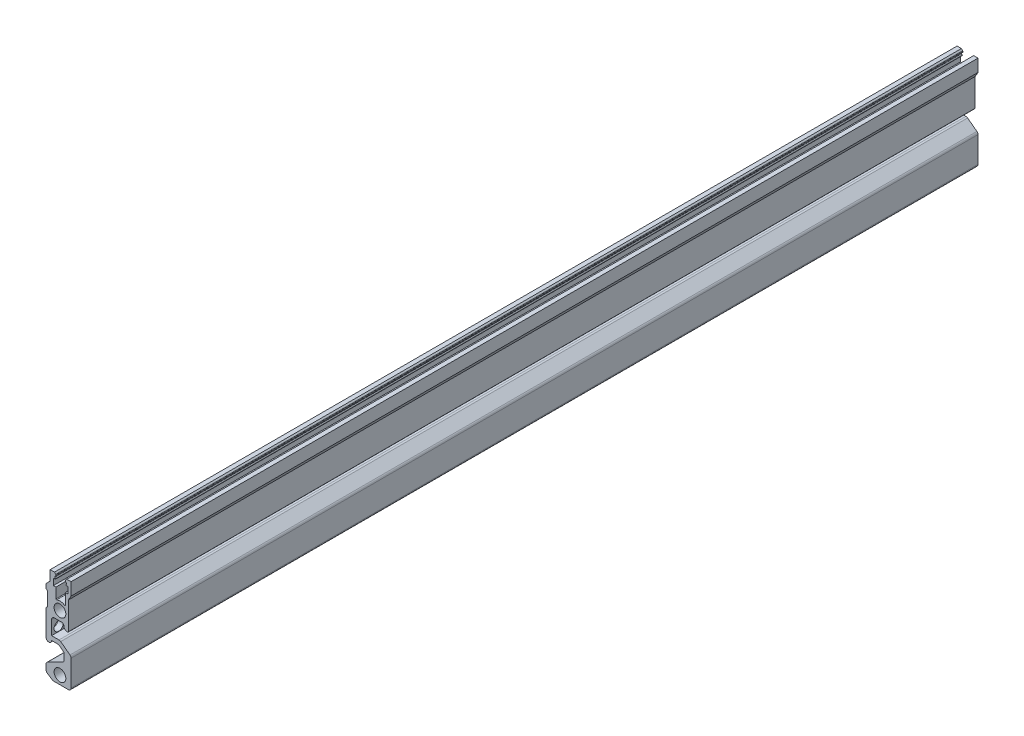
SolidWorks part; units mm, degrees
ref_plane "前视基准面" through (0, 0, 0) normal (0, 0, 1) x (1, 0, 0)
ref_plane "上视基准面" through (0, 0, 0) normal (0, 1, 0) x (1, 0, 0)
ref_plane "右视基准面" through (0, 0, 0) normal (1, 0, 0) x (0, 0, -1)
sketch "草图1" plane through (0, 0, 0) normal (0, 0, 1) x (1, 0, 0)
  line L0 (-2.3509, 8.9116) -> (-2.3509, 6.6116)
  line L1 (-2.3509, 8.9116) -> (-1.4509, 8.9116)
  line L2 (-1.4509, 8.9116) -> (-1.4509, 11.7916)
  line L3 (-1.4509, 11.7916) -> (-4.1259, 11.7916)
  line L4 (-4.1259, 11.7916) -> (-4.1259, 10.0616)
  line L5 (-4.1259, 10.0616) -> (-3.5009, 9.8916)
  line L6 (-3.5009, 9.8916) -> (-3.5009, 8.5216)
  line L7 (-3.5009, 8.5216) -> (-5.0009, 8.5216)
  line L8 (-5.0009, 8.5216) -> (-5.0009, 4.4416)
  line L9 (-5.0009, 4.4416) -> (-4.5507, 3.9414)
  line L10 (-4.5507, 3.9414) -> (-4.551, -1.0586)
  line L11 (-4.551, -1.0586) -> (-5.0009, -1.5584)
  line L12 (-5.0009, -1.5584) -> (-5.0009, -10.75)
  line L13 (-3.0009, -9.25) -> (-3.0009, -5.75)
  line L14 (2.9991, -5.05) -> (2.9991, -2.0584)
  line L15 (3.2991, -1.7584) -> (3.6991, -1.7584)
  line L16 (3.9991, -2.0584) -> (3.9991, -3.4584)
  line L17 (4.2991, -3.7584) -> (4.6991, -3.7584)
  line L18 (4.9991, -3.4584) -> (4.9991, 2.6416)
  line L19 (4.6991, 2.9416) -> (4.2991, 2.9416)
  line L20 (3.9991, 2.6416) -> (3.9991, 1.2416)
  line L21 (3.6991, 0.9416) -> (3.2991, 0.9416)
  line L22 (2.9991, 1.2416) -> (2.9991, 4.8054)
  line L23 (2.9991, 4.8054) -> (3.9991, 6.5374)
  line L24 (3.9991, 6.5374) -> (3.9991, 9.5216)
  line L25 (3.9991, 9.5216) -> (3.1241, 9.5216)
  line L26 (3.1241, 10.7916) -> (3.1241, 11.7916)
  line L27 (3.1241, 11.7916) -> (1.9491, 11.7916)
  line L28 (1.9491, 11.7916) -> (1.9491, 8.9116)
  line L29 (1.9491, 8.9116) -> (2.8491, 8.9116)
  line L30 (2.8491, 6.6116) -> (2.8491, 8.9116)
  line L31 (2.8491, 6.6116) -> (1.9491, 6.6116)
  line L32 (1.9491, 6.6116) -> (1.9491, 2.6797)
  line L33 (-1.4509, 2.9454) -> (-1.4509, 6.6116)
  line L34 (-1.4509, 6.6116) -> (-2.3509, 6.6116)
  line L35 (0, 0) -> (0, -5) construction
  line L39 (-2.5009, -5.25) -> (2.7991, -5.25)
  line L40 (-1.4509, 10.3516) -> (1.9491, 10.3516) construction
  line L41 (-3.0009, -10.75) -> (-5.0009, -10.75) construction
  line L42 (0.2491, 10.3516) -> (0.2491, 6.8507) construction
  line L43 (1.4991, -10.75) -> (1.4991, -17.25)
  line L44 (2.9991, -10.05) -> (2.9991, -22.2)
  line L45 (-3.0009, -10.75) -> (1.4991, -10.75)
  line L46 (-3.0009, -9.25) -> (2.1991, -9.25)
  line L47 (-5.0009, -22.2) -> (-5.0009, -18.05)
  line L48 (2.1991, -23) -> (-4.2009, -23)
  line L49 (-4.2009, -17.25) -> (1.4991, -17.25)
  arc A1 (3.2991, -1.7584) -> (2.9991, -2.0584) centre (3.2991, -2.0584) ccw
  arc A2 (3.9991, -2.0584) -> (3.6991, -1.7584) centre (3.6991, -2.0584) ccw
  arc A3 (3.9991, -3.4584) -> (4.2991, -3.7584) centre (4.2991, -3.4584) ccw
  arc A4 (4.6991, -3.7584) -> (4.9991, -3.4584) centre (4.6991, -3.4584) ccw
  arc A5 (4.9991, 2.6416) -> (4.6991, 2.9416) centre (4.6991, 2.6416) ccw
  arc A6 (4.2991, 2.9416) -> (3.9991, 2.6416) centre (4.2991, 2.6416) ccw
  arc A7 (3.6991, 0.9416) -> (3.9991, 1.2416) centre (3.6991, 1.2416) ccw
  arc A8 (2.9991, 1.2416) -> (3.2991, 0.9416) centre (3.2991, 1.2416) ccw
  arc A9 (3.1241, 10.7916) -> (3.1241, 9.5216) centre (3.1841, 10.1566) ccw
  circle A10 centre (0, 0) radius 1.6
  arc A11 (1.6398, 2.5122) -> (-1.1727, 2.7613) centre (0, 0) ccw
  arc A12 (1.6398, 2.5122) -> (1.9491, 2.6797) centre (1.7491, 2.6797) ccw
  arc A13 (-1.4509, 2.9454) -> (-1.1727, 2.7613) centre (-1.2509, 2.9454) ccw
  arc A17 (-4.2009, -17.25) -> (-5.0009, -18.05) centre (-4.2009, -18.05) ccw
  arc A18 (2.1991, -23) -> (2.9991, -22.2) centre (2.1991, -22.2) ccw
  arc A19 (2.7991, -5.25) -> (2.9991, -5.05) centre (2.7991, -5.05) ccw
  arc A20 (-3.0009, -5.75) -> (-2.5009, -5.25) centre (-2.5009, -5.75) cw
  circle A21 centre (0, -20) radius 1.6
  arc A22 (-5.0009, -22.2) -> (-4.2009, -23) centre (-4.2009, -22.2) ccw
  arc A23 (2.9991, -10.05) -> (2.1991, -9.25) centre (2.1991, -10.05) ccw
  arc A28 (-5.0009, -10.75) -> (-3.0009, -10.75) centre (-4.0009, -10.75) ccw
  dimension "D3" = 1.5
  dimension "D6" = 3.2
  dimension "D7" = 20
  dimension "D17" = 0.8
  dimension "D18" = 0.8
  dimension "D19" = 0.8
  dimension "D20" = 0.8
  dimension "D5" = 5.2
  dimension "D8" = 1
  dimension "D10" = 34.7916
  dimension "D12" = 5.75
  dimension "D13" = 13.75
  dimension "D16" = 8
extrude "凸台-拉伸1" add sketch "草图1" along normal mid plane 325.12
sketch "草图2" plane through (0, 0, -162.56) normal (0, 0, -1) x (-1, 0, 0)
  circle A0 centre (0, 0) radius 2.1
  circle A1 centre (0, -20) radius 2.1
  dimension "D1" = 4.2
  dimension "D2" = 4.2
extrude "切除-拉伸1" cut sketch "草图2" against normal blind 10
sketch "草图3" plane through (0, 0, 162.56) normal (0, 0, 1) x (1, 0, 0)
  circle A0 centre (0, 0) radius 2.1
  circle A1 centre (0, -20) radius 2.1
  dimension "D1" = 4.2
  dimension "D2" = 4.2
extrude "切除-拉伸2" cut sketch "草图3" against normal blind 10
sketch "草图4" plane through (-5.0009, 0, 0) normal (-1, 0, 0) x (0, 0, 1)
  line L0 (-162.56, -1.5584) -> (-162.56, -10.75) construction
  line L2 (-162.56, -11.75) -> (162.56, -11.75) construction
  circle A0 centre (-160.02, -7.5) radius 1.65
  circle A1 centre (-154.94, -7.5) radius 1.65
  circle A2 centre (-149.86, -7.5) radius 1.65
  circle A3 centre (-144.78, -7.5) radius 1.65
  circle A4 centre (-139.7, -7.5) radius 1.65
  circle A5 centre (-134.62, -7.5) radius 1.65
  circle A6 centre (-129.54, -7.5) radius 1.65
  circle A7 centre (-124.46, -7.5) radius 1.65
  circle A8 centre (-119.38, -7.5) radius 1.65
  circle A9 centre (-114.3, -7.5) radius 1.65
  circle A10 centre (-109.22, -7.5) radius 1.65
  circle A11 centre (-104.14, -7.5) radius 1.65
  circle A12 centre (-99.06, -7.5) radius 1.65
  circle A13 centre (-93.98, -7.5) radius 1.65
  circle A14 centre (-88.9, -7.5) radius 1.65
  circle A15 centre (-83.82, -7.5) radius 1.65
  circle A16 centre (-78.74, -7.5) radius 1.65
  circle A17 centre (-73.66, -7.5) radius 1.65
  circle A18 centre (-68.58, -7.5) radius 1.65
  circle A19 centre (-63.5, -7.5) radius 1.65
  circle A20 centre (-58.42, -7.5) radius 1.65
  circle A21 centre (-53.34, -7.5) radius 1.65
  circle A22 centre (-48.26, -7.5) radius 1.65
  circle A23 centre (-43.18, -7.5) radius 1.65
  circle A24 centre (-38.1, -7.5) radius 1.65
  circle A25 centre (-33.02, -7.5) radius 1.65
  circle A26 centre (-27.94, -7.5) radius 1.65
  circle A27 centre (-22.86, -7.5) radius 1.65
  circle A28 centre (-17.78, -7.5) radius 1.65
  circle A29 centre (-12.7, -7.5) radius 1.65
  circle A30 centre (-7.62, -7.5) radius 1.65
  circle A31 centre (-2.54, -7.5) radius 1.65
  circle A32 centre (2.54, -7.5) radius 1.65
  circle A33 centre (7.62, -7.5) radius 1.65
  circle A34 centre (12.7, -7.5) radius 1.65
  circle A35 centre (17.78, -7.5) radius 1.65
  circle A36 centre (22.86, -7.5) radius 1.65
  circle A37 centre (27.94, -7.5) radius 1.65
  circle A38 centre (33.02, -7.5) radius 1.65
  circle A39 centre (38.1, -7.5) radius 1.65
  circle A40 centre (43.18, -7.5) radius 1.65
  circle A41 centre (48.26, -7.5) radius 1.65
  circle A42 centre (53.34, -7.5) radius 1.65
  circle A43 centre (58.42, -7.5) radius 1.65
  circle A44 centre (63.5, -7.5) radius 1.65
  circle A45 centre (68.58, -7.5) radius 1.65
  circle A46 centre (73.66, -7.5) radius 1.65
  circle A47 centre (78.74, -7.5) radius 1.65
  circle A48 centre (83.82, -7.5) radius 1.65
  circle A49 centre (88.9, -7.5) radius 1.65
  circle A50 centre (93.98, -7.5) radius 1.65
  circle A51 centre (99.06, -7.5) radius 1.65
  circle A52 centre (104.14, -7.5) radius 1.65
  circle A53 centre (109.22, -7.5) radius 1.65
  circle A54 centre (114.3, -7.5) radius 1.65
  circle A55 centre (119.38, -7.5) radius 1.65
  circle A56 centre (124.46, -7.5) radius 1.65
  circle A57 centre (129.54, -7.5) radius 1.65
  circle A58 centre (134.62, -7.5) radius 1.65
  circle A59 centre (139.7, -7.5) radius 1.65
  circle A60 centre (144.78, -7.5) radius 1.65
  circle A61 centre (149.86, -7.5) radius 1.65
  circle A62 centre (154.94, -7.5) radius 1.65
  circle A63 centre (160.02, -7.5) radius 1.65
  circle A64 centre (165.1, -7.5) radius 1.65
  circle A65 centre (170.18, -7.5) radius 1.65
  circle A66 centre (175.26, -7.5) radius 1.65
  circle A67 centre (180.34, -7.5) radius 1.65
  circle A68 centre (185.42, -7.5) radius 1.65
  circle A69 centre (190.5, -7.5) radius 1.65
  circle A70 centre (195.58, -7.5) radius 1.65
  circle A71 centre (200.66, -7.5) radius 1.65
  circle A72 centre (205.74, -7.5) radius 1.65
  circle A73 centre (210.82, -7.5) radius 1.65
  circle A74 centre (215.9, -7.5) radius 1.65
  circle A75 centre (220.98, -7.5) radius 1.65
  circle A76 centre (226.06, -7.5) radius 1.65
  circle A77 centre (231.14, -7.5) radius 1.65
  circle A78 centre (236.22, -7.5) radius 1.65
  circle A79 centre (241.3, -7.5) radius 1.65
  circle A80 centre (246.38, -7.5) radius 1.65
  circle A81 centre (251.46, -7.5) radius 1.65
  circle A82 centre (256.54, -7.5) radius 1.65
  circle A83 centre (261.62, -7.5) radius 1.65
  circle A84 centre (266.7, -7.5) radius 1.65
  dimension "D1" = 3.3
  dimension "D5" = 5.08
  dimension "D3" = 4.25
  dimension "D2" = 2.54
  dimension "D4" = 85
extrude "切除-拉伸3" cut sketch "草图4" against normal blind 12
sketch "草图5" plane through (0, 0, 162.56) normal (0, 0, 1) x (1, 0, 0)
  line L0 (1.9491, 8.9116) -> (2.8491, 8.9116) construction
  line L1 (1.9491, 8.9116) -> (3.9991, 8.9116)
  line L2 (1.9491, 8.9116) -> (1.9491, 11.7916)
  line L3 (1.9491, 11.7916) -> (3.9991, 11.7916)
  line L4 (3.9991, 8.9116) -> (3.9991, 11.7916)
  line L5 (3.1241, 11.7916) -> (1.9491, 11.7916) construction
  line L6 (3.9991, 6.5374) -> (3.9991, 9.5216) construction
  line L7 (-1.4509, 11.7916) -> (-4.1259, 11.7916) construction
  line L8 (-5.0009, 8.5216) -> (-2.7884, 8.5216)
  line L9 (-5.0009, 8.5216) -> (-5.0009, 11.7916)
  line L10 (-5.0009, 11.7916) -> (-2.7884, 11.7916)
  line L11 (-2.7884, 8.5216) -> (-2.7884, 11.7916)
extrude "凸台-拉伸2" add sketch "草图5" against normal up to surface (325.12 mm away)
sketch "草图6" plane through (0, 0, -162.56) normal (0, 0, -1) x (-1, 0, 0)
  line L0 (-1.9491, 9.4916) -> (1.4509, 9.4916) construction
  line L1 (-1.9491, 11.7916) -> (-1.9491, 8.9116) construction
  line L2 (1.4509, 8.9116) -> (1.4509, 11.7916) construction
  line L3 (1.4509, 11.7916) -> (5.0009, 11.7916) construction
  line L4 (-2.3491, 8.9916) -> (1.8509, 8.9916)
  line L5 (-2.3491, 8.9916) -> (-2.3491, 9.9916)
  line L6 (-2.3491, 9.9916) -> (1.8509, 9.9916)
  line L7 (1.8509, 8.9916) -> (1.8509, 9.9916)
  line L8 (-2.3491, 8.9916) -> (1.8509, 9.9916) construction
  line L9 (-2.3491, 9.9916) -> (1.8509, 8.9916) construction
  point P6 (-0.2491, 9.4916)
  dimension "D1" = 1
  dimension "D2" = 4.2
  dimension "D3" = 1.8
extrude "切除-拉伸4" cut sketch "草图6" against normal through all
sketch "草图8" plane through (0, 0, -162.56) normal (0, 0, -1) x (-1, 0, 0)
  line L0 (5.0009, 11.7916) -> (5.0009, 4.4416) construction
  line L1 (-3.9991, 11.7916) -> (5.0009, 11.7916)
  line L2 (-3.9991, 11.7916) -> (-3.9991, 11.0016)
  line L3 (-3.9991, 11.0016) -> (5.0009, 11.0016)
  line L4 (5.0009, 11.7916) -> (5.0009, 11.0016)
  dimension "D1" = 0.79
extrude "切除-拉伸6" cut sketch "草图8" against normal through all
fillet "圆角1" radius 0.5 4 edges at (-1.8509, 9.9916, 0) (-1.8509, 8.9916, 0) (2.3491, 9.9916, 0) (2.3491, 8.9916, 0)
chamfer "倒角1" distance 0.5 angle 45 2 edges at (-1.4509, 11.0016, 0) (1.9491, 11.0016, 0)
fillet "圆角2" radius 0.2 6 edges at (1.9491, 10.5016, 0) (-1.4509, 10.5016, 0) (-1.4509, 8.9916, 0) (-1.4509, 9.9916, 0) (1.9491, 8.9916, 0) (1.9491, 9.9916, 0)
fillet "圆角3" radius 0.1 2 edges at (-1.4509, 8.9116, 0) (1.9491, 8.9116, 0)
sketch "草图7" plane through (0, 0, -162.56) normal (0, 0, -1) x (-1, 0, 0)
  line L0 (5.0009, 11.0016) -> (3.5009, 11.0016)
  line L2 (3.5009, 11.0016) -> (3.5009, 7.4416)
  line L3 (3.5009, 7.4416) -> (5.0009, 5.9416)
  line L4 (5.0009, 11.0016) -> (5.0009, 4.4416) construction
  line L5 (5.0009, 5.9416) -> (5.0009, 11.0016)
  line L6 (1.4509, 10.1341) -> (1.4509, 10.4187) construction
  line L7 (1.9509, 11.0016) -> (5.0009, 11.0016) construction
  dimension "D1" = 2.05
  dimension "D2" = 1.5
  dimension "D3" = 45
extrude "切除-拉伸5" cut sketch "草图7" against normal through all
sketch "草图10" plane through (0, 0, -162.56) normal (0, 0, -1) x (-1, 0, 0)
  line L0 (5.0009, -19.75) -> (1.0009, -23)
  line L3 (5.0009, -18.05) -> (5.0009, -22.2) construction
  line L4 (4.2009, -23) -> (-2.1991, -23) construction
  line L5 (1.0009, -23) -> (6.263, -23)
  line L6 (6.263, -23) -> (6.263, -19.75)
  line L7 (6.263, -19.75) -> (5.0009, -19.75)
  line L8 (-1.4991, -17.25) -> (4.2009, -17.25) construction
  dimension "D1" = 2.5
  dimension "D2" = 4
extrude "切除-拉伸7" [suppressed] cut sketch "草图10" against normal through all
fillet "圆角4" [suppressed] radius 0.8
sketch "草图11" plane through (0, 0, -162.56) normal (0, 0, -1) x (-1, 0, 0)
  line L2 (5.0009, -18.05) -> (5.0009, -22.2) construction
  line L7 (5.0009, -21.375) -> (5.0009, -23)
  line L8 (5.0009, -23) -> (2.5009, -23)
  line L9 (4.2009, -23) -> (-2.1991, -23) construction
  line L10 (2.5009, -23) -> (5.0009, -21.375)
  line L11 (5.0009, -20.125) -> (-2.9991, -20.125) construction
  line L12 (-2.9991, -22.2) -> (-2.9991, -10.05) construction
  line L13 (3.0009, -6.25) -> (3.0009, -3.25)
  line L14 (3.0009, -9.25) -> (3.0009, -5.75) construction
  line L15 (3.0009, -3.25) -> (-1.4991, -3.25)
  line L16 (-1.4991, -3.25) -> (-1.4991, -6.25)
  line L17 (3.0009, -6.25) -> (-1.4991, -6.25)
  line L18 (2.5009, -5.25) -> (-2.7991, -5.25) construction
  line L20 (-2.9991, -5.05) -> (-2.9991, -2.0584) construction
  dimension "D1" = 1.625
  dimension "D4" = 5.5
  dimension "D5" = 2
  dimension "D6" = 3
  dimension "D7" = 1.5
extrude "切除-拉伸8" cut sketch "草图11" against normal through all
sketch "草图12" plane through (0, 0, -162.56) normal (0, 0, -1) x (-1, 0, 0)
  line L0 (2.5009, -17.25) -> (-1.4991, -17.25)
  line L1 (-1.4991, -17.25) -> (-1.4991, -15.25)
  line L2 (-1.4991, -15.25) -> (2.5009, -17.25)
  line L3 (0.5009, -10.75) -> (-1.4991, -12.25)
  line L4 (3.0009, -10.75) -> (-1.4991, -10.75) construction
  line L5 (-1.4991, -10.75) -> (-1.4991, -17.25) construction
  line L6 (-1.4991, -12.25) -> (-1.4991, -10.75)
  line L7 (-1.4991, -10.75) -> (0.5009, -10.75)
  dimension "D1" = 2
  dimension "D2" = 1.5
  dimension "D3" = 2
extrude "凸台-拉伸3" add sketch "草图12" against normal through all
sketch "草图14" plane through (0, 0, -162.56) normal (0, 0, -1) x (-1, 0, 0)
  line L0 (0.0009, -9.25) -> (-2.9991, -11.5)
  line L1 (-2.1991, -9.25) -> (3.0009, -9.25) construction
  line L2 (-2.9991, -22.2) -> (-2.9991, -10.05) construction
  line L3 (-2.9991, -11.5) -> (-2.9991, -9.25)
  line L4 (-2.9991, -9.25) -> (0.0009, -9.25)
  line L5 (-1.4991, -12.25) -> (0.5009, -10.75) construction
  line L6 (2.5009, -17.25) -> (5.961, -18.98)
  line L7 (5.961, -18.98) -> (5.961, -16.25)
  line L8 (5.961, -16.25) -> (2.5009, -17.25)
  dimension "D1" = 1.5
extrude "切除-拉伸10" cut sketch "草图14" against normal through all
fillet "圆角6" radius 1 10 edges at (-5.0009, -21.375, 0) (-5.0009, -18.5, 0) (1.4991, -15.25, 0) (-2.5009, -23, 0) (-0.5009, -10.75, 0) (2.9991, -11.5, 0) (-0.0009, -9.25, 0) (-3.0009, -3.25, 0) (1.4991, -3.25, 0) (1.4991, -5.25, 0)
sketch "草图15" plane through (0, 0, -162.56) normal (0, 0, -1) x (-1, 0, 0)
  line L0 (-2.1991, -23) -> (-2.9991, -23)
  line L1 (-2.9991, -23) -> (-2.9991, -22.2)
  line L2 (-2.9991, -22.2) -> (-2.1991, -23)
  line L3 (2.2044, -23) -> (-2.1991, -23) construction
  line L4 (-2.9991, -12) -> (-2.5991, -11.2)
  line L5 (-2.5991, -11.2) -> (-2.9991, -11.5)
  line L6 (-2.9991, -12) -> (-2.9991, -11.5)
extrude "凸台-拉伸4" add sketch "草图15" against normal through all
sketch "草图16" plane through (0, 0, -162.56) normal (0, 0, -1) x (-1, 0, 0)
  line L0 (-2.9991, -11.5) -> (-3.9991, -12.25)
  line L1 (-2.9991, -23) -> (-3.9991, -23)
  line L2 (-2.9991, -23) -> (-2.9991, -11.5)
  line L3 (-2.9991, -11.5) -> (-0.2658, -9.45) construction
  line L4 (-3.9991, -23) -> (-3.9991, -12.25)
  dimension "D1" = 1
extrude "凸台-拉伸5" add sketch "草图16" against normal through all
fillet "圆角7" radius 1 2 edges at (3.9991, -12.25, 0) (3.9991, -23, 0)
sketch "草图17" plane through (0, 0, -162.56) normal (0, 0, -1) x (-1, 0, 0)
  line L0 (-2.9991, -5.05) -> (-2.9991, -2.0584) construction
  line L1 (-2.9991, -6.1776) -> (-6.0043, -6.1776)
  line L2 (-2.9991, -6.1776) -> (-2.9991, 3.4413)
  line L3 (-2.9991, 3.4413) -> (-6.0043, 3.4413)
  line L4 (-6.0043, -6.1776) -> (-6.0043, 3.4413)
  line L5 (-2.9991, 1.2416) -> (-2.9991, 4.8054) construction
extrude "切除-拉伸11" cut sketch "草图17" against normal through all
